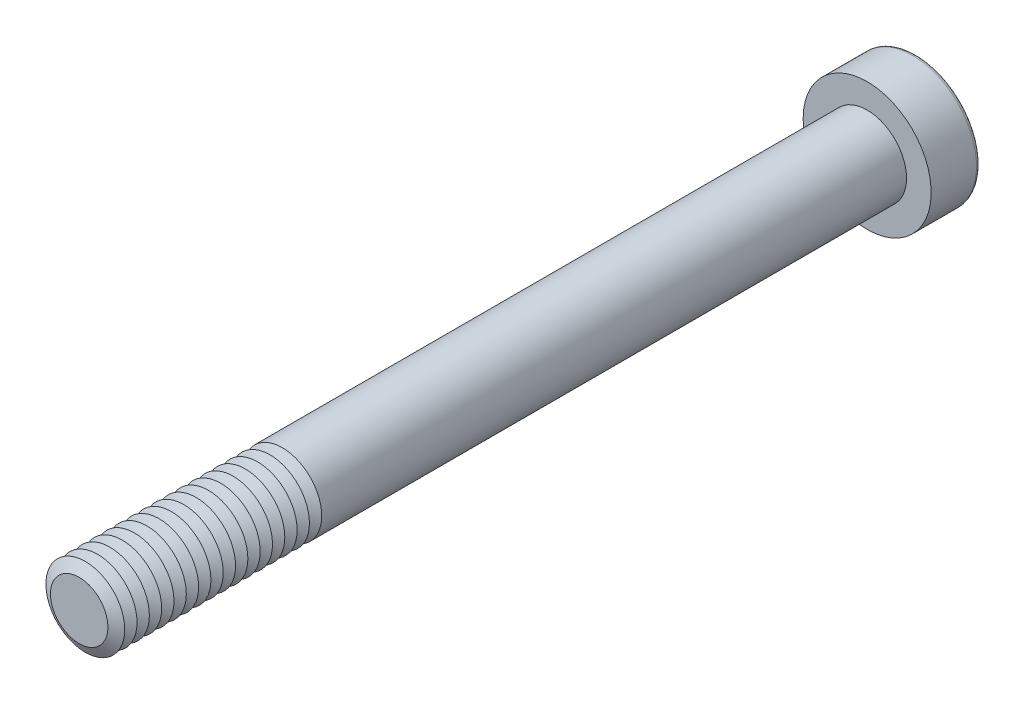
SolidWorks part; units mm, degrees
ref_plane "Front Plane" through (0, 0, 0) normal (0, 0, 1) x (1, 0, 0)
ref_plane "Top Plane" through (0, 0, 0) normal (0, 1, 0) x (1, 0, 0)
ref_plane "Right Plane" through (0, 0, 0) normal (1, 0, 0) x (0, 0, -1)
sketch "Sketch1" plane through (0, 0, 0) normal (0, 0, 1) x (1, 0, 0)
  circle A0 centre (0, 0) radius 4
  dimension "D1" = 8
extrude "Boss-Extrude1" add sketch "Sketch1" along normal blind 80
sketch "Sketch2" plane through (0, 0, 0) normal (0, 0, -1) x (-1, 0, 0)
  circle A0 centre (0, 0) radius 6.5
  dimension "D1" = 13
extrude "Boss-Extrude2" add sketch "Sketch2" along normal blind 5
sketch "Sketch3" plane through (0, 0, -5) normal (0, 0, -1) x (-1, 0, 0)
  line L1 (-1.4434, 2.5) -> (-2.8868, 0)
  line L2 (-2.8868, 0) -> (-1.4434, -2.5)
  line L3 (-1.4434, -2.5) -> (1.4434, -2.5)
  line L4 (1.4434, -2.5) -> (2.8868, 0)
  line L5 (2.8868, 0) -> (1.4434, 2.5)
  line L6 (1.4434, 2.5) -> (-1.4434, 2.5)
  circle A0 centre (0, 0) radius 2.5 construction
  dimension "D1" = 5
extrude "Cut-Extrude1" cut sketch "Sketch3" against normal blind 3.75
fillet "Fillet1" radius 0.4 1 edges at (-6.5, 0, -5)
sketch "Sketch4" plane through (0, 0, -1.25) normal (0, 0, -1) x (-1, 0, 0)
  line L0 (1.4434, -2.5) -> (2.8868, 0) construction
  circle A0 centre (0, 0) radius 2.5
extrude "Cut-Extrude2" cut sketch "Sketch4" against normal through all draft 60
sketch "Sketch5" plane through (0, 0, -5) normal (0, 0, -1) x (-1, 0, 0)
  circle A0 centre (0, 0) radius 2.8868
extrude "Cut-Extrude3" cut sketch "Sketch5" against normal through all draft 75
sketch "Sketch7" plane through (0, 0, 0) normal (1, 0, 0) x (0, 0, -1)
  line L25 (-80, 2.9175) -> (-79.375, 4)
  line L26 (-80, 4) -> (-80, -4) construction
  line L27 (-79.375, 4) -> (-80.625, 4)
  line L28 (-80.625, 4) -> (-80, 2.9175)
  line L29 (0, 4) -> (-80, 4) construction
  dimension "D1" = 1.25
revolve "Cut-Revolve1" cut sketch "Sketch7" angle 360 about axis through (0, 0, 80) along (0, 0, -1)
pattern_linear "LPattern1" count 17 spacing 1.25 along (0, 0, -1) of "Cut-Revolve1"
